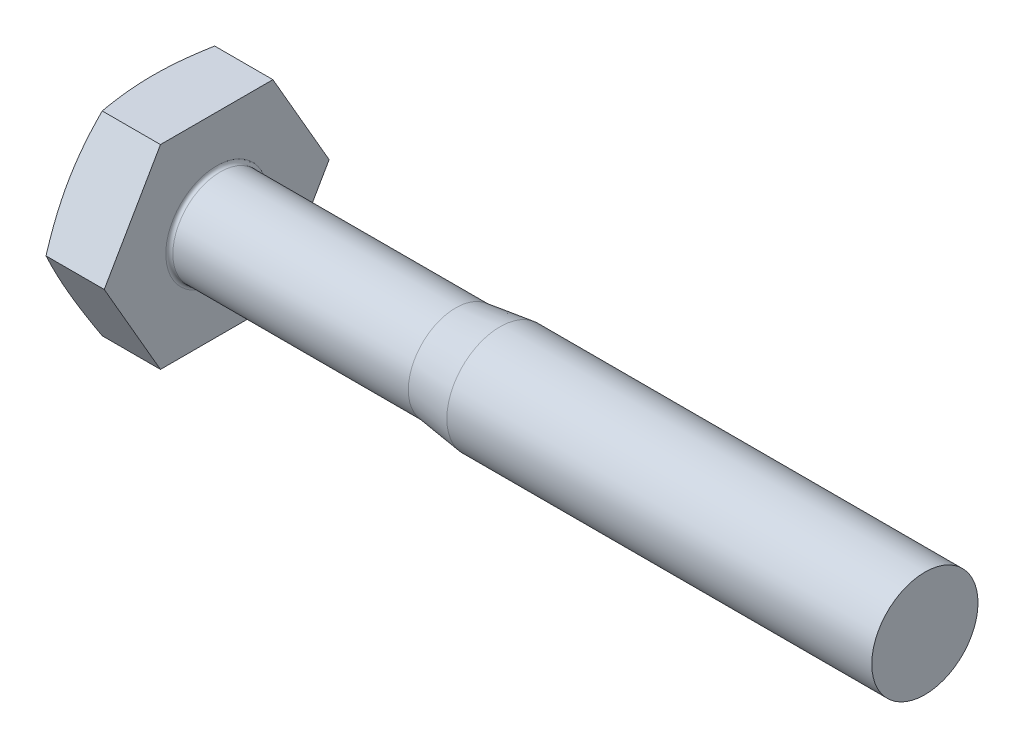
SolidWorks part; units mm, degrees
ref_plane "Front" through (0, 0, 0) normal (0, 0, 1) x (1, 0, 0)
ref_plane "Top" through (0, 0, 0) normal (0, 1, 0) x (1, 0, 0)
ref_plane "Right" through (0, 0, 0) normal (1, 0, 0) x (0, 0, -1)
sketch "Sketch1" plane through (0, 0, 0) normal (1, 0, 0) x (0, 0, -1)
  line L1 (3.1754, 0) -> (1.5877, 2.75)
  line L2 (1.5877, 2.75) -> (-1.5877, 2.75)
  line L3 (-1.5877, 2.75) -> (-3.1754, 0)
  line L4 (-3.1754, 0) -> (-1.5877, -2.75)
  line L5 (-1.5877, -2.75) -> (1.5877, -2.75)
  line L6 (1.5877, -2.75) -> (3.1754, 0)
  circle A0 centre (0, 0) radius 2.75 construction
  dimension "s" = 5.5
extrude "BaseHead" add sketch "Sketch1" along normal blind 2
ref_plane "Plane1" through (10, 0, 0) normal (1, 0, 0) x (0, 0, -1)
sketch "Sketch2" plane through (2, 0, 0) normal (1, 0, 0) x (0, 0, -1)
  circle A0 centre (0, 0) radius 1.5
  dimension "d" = 3
extrude "BaseBody" add sketch "Sketch2" along normal blind 20
sketch "Sketch3" plane through (3.1612, 0, 2.6123) normal (0, 1, 0) x (0, 0, -1)
  line L0 (2.6123, 5.2326) -> (2.6123, 1.6388) construction
  line L2 (5.7877, 3.1612) -> (5.7877, 2.8062)
  line L3 (5.7877, 2.8062) -> (4.8123, 3.1612)
  line L5 (4.8123, 3.1612) -> (5.7877, 3.1612)
  dimension "D1" = 20
  dimension "dw" = 4.4
revolve "HeadChamfer" cut sketch "Sketch3" angle 360 about L0
sketch "Sketch4" plane through (0, 0, 0) normal (-1, 0, 0) x (0, 0, 1)
  circle A0 centre (0, 0) radius 1.8
  dimension "da" = 3.6
extrude "Cut-Extrude1" cut sketch "Sketch4" against normal blind 0.4
sketch "Sketch5" plane through (-2.6796, 0, 8.1796) normal (0, 1, 0) x (0, 0, -1)
  line L0 (8.1796, 0.0175) -> (8.1796, -16.2361) construction
  line L2 (9.6796, -12.6796) -> (9.5171, -11.4296)
  line L4 (9.5171, -11.4296) -> (9.5171, -4.6796)
  line L6 (9.5171, -4.6796) -> (10.8546, -4.6796)
  line L7 (10.8546, -4.6796) -> (10.8546, -12.6796)
  line L8 (10.8546, -12.6796) -> (9.6796, -12.6796)
  line L11 (8.1796, -24.6796) -> (8.1796, -4.6796) construction
  line L14 (9.7673, -4.6796) -> (6.5919, -4.6796) construction
  line L16 (6.6796, -24.6796) -> (9.6796, -24.6796) construction
  line L17 (9.6796, -24.6796) -> (9.6796, -4.6796) construction
  dimension "ds" = 2.675
  dimension "x" = 1.25
  dimension "D3" = 12
  dimension "D4" = 5.35
revolve "Cut-Revolve1" cut sketch "Sketch5" angle 360 about L0
fillet "HeadFillet" radius 0.1 1 edges at (2, 0, 1.3375)
equation "\"D1@Cut-Extrude1\" = 0.2 * \"k@BaseHead\""
equation "\"b@ThreadCosmetic1\" = \"l@BaseBody\" - \"lg@Plane1\""
equation "\"D4@Sketch5\" = 2 * \"ds@Sketch5\""
equation "\"D3@Sketch5\" = \"l@BaseBody\" - \"lg@Plane1\""
